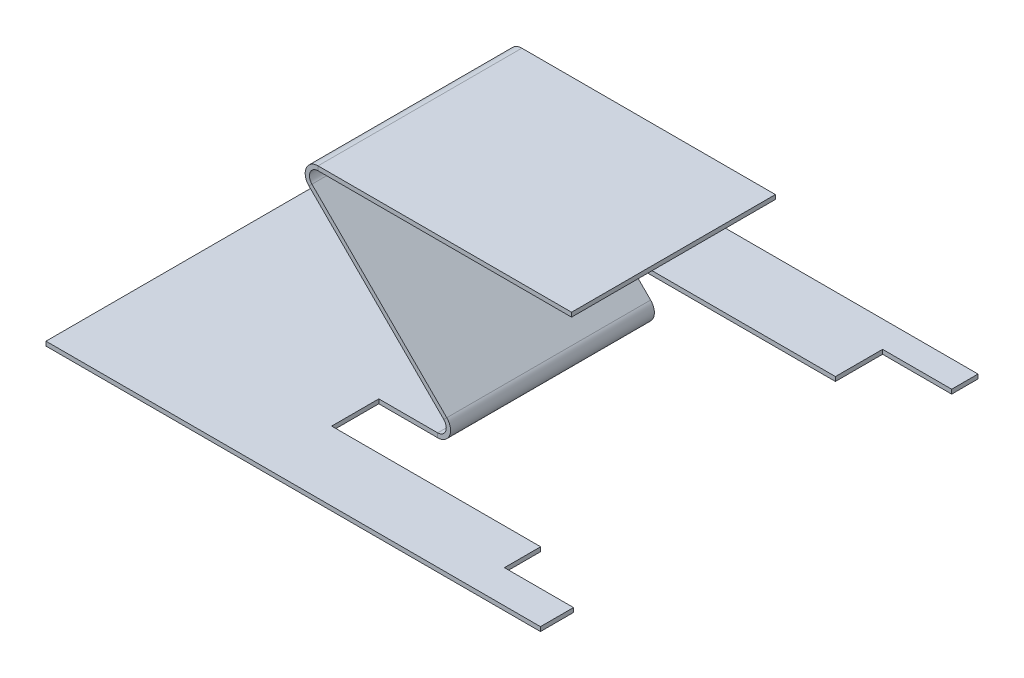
SolidWorks part; units mm, degrees
ref_plane "Front" through (0, 0, 0) normal (0, 0, 1) x (1, 0, 0)
ref_plane "Top" through (0, 0, 0) normal (0, 1, 0) x (1, 0, 0)
ref_plane "Right" through (0, 0, 0) normal (1, 0, 0) x (0, 0, -1)
sketch "Sketch1" plane through (105.9594, 0, -3.7403) normal (0, 1, 0) x (-1, 0, 0)
  line L0 (16.1231, 36.7583) -> (64.8941, 36.7583)
  line L1 (0, 52.9252) -> (115.3881, 52.9252)
  line L2 (0, 52.9252) -> (0, 45.21)
  line L3 (0, -49.1849) -> (115.3881, -49.1849)
  line L4 (115.3881, 52.9252) -> (115.3881, -49.1849)
  line L5 (64.8941, 36.7583) -> (64.8941, 25.7513)
  line L6 (64.8941, -32.0352) -> (16.1231, -32.0352)
  line L7 (16.1231, 36.7583) -> (16.1231, 45.21)
  line L8 (16.1231, 45.21) -> (0, 45.21)
  line L9 (16.1231, -32.0352) -> (16.1231, -43.0422)
  line L10 (16.1231, -43.0422) -> (0, -43.0422)
  line L11 (0, -43.0422) -> (0, -49.1849)
  line L12 (64.8941, 25.7513) -> (-9.4287, 25.7513)
  line L13 (-9.4287, 25.7513) -> (-9.4287, -21.8145)
  line L14 (-9.4287, -21.8145) -> (64.8941, -21.8145)
  line L15 (64.8941, -21.8145) -> (64.8941, -32.0352)
sheet metal parameters "Sheet-Metal2" thickness 1 parameters "D1"=2
base flange "Base-Flange2" sketch "Sketch1" thickness 1 reverse thickness direction yes parameters "D1"=2
sketch "Sketch5" plane through (0, 1, 0) normal (0, 1, 0) x (-1, 0, 0)
  line L0 (-57.7526, 22.011) -> (-57.7526, -25.5548)
  line L1 (-41.0653, 22.011) -> (-115.3881, 22.011) construction
  line L2 (-115.3881, -25.5548) -> (-41.0653, -25.5548) construction
jog "Jog5" parameters "D1"=2
bend "JogBend9" bend radius 2 bend angle 135 parameters "D5"=1
bend "JogBend10" bend radius 2 bend angle 135 parameters "D5"=2
flat pattern "Flat-Pattern2"
sketch "Bend-Lines2" plane through (0, 1, 0) normal (0, 1, 0) x (-1, 0, 0)
  line L0 (-108.1406, 22.011) -> (-108.1406, -25.5548) construction
  line L1 (-57.7526, 22.011) -> (-57.7526, -25.5548) construction
  line L2 (-108.1406, 22.011) -> (-108.1406, -25.5548) construction
  line L3 (-57.7526, 22.011) -> (-57.7526, -25.5548) construction
sketch3d "Bounding-Box1" [suppressed]
  line L0 (-64.293, -94.3949, 0) -> (115.3881, -94.3949, 0) construction
  line L1 (-64.293, 7.7151, 0) -> (115.3881, 7.7151, 0) construction
  line L2 (-64.293, -94.3949, 0) -> (-64.293, 7.7151, 0) construction
  line L3 (115.3881, -94.3949, 0) -> (115.3881, 7.7151, 0) construction
bend of the flat pattern "Flatten-<JogBend9>2"
bend of the flat pattern "Flatten-<JogBend10>2"
